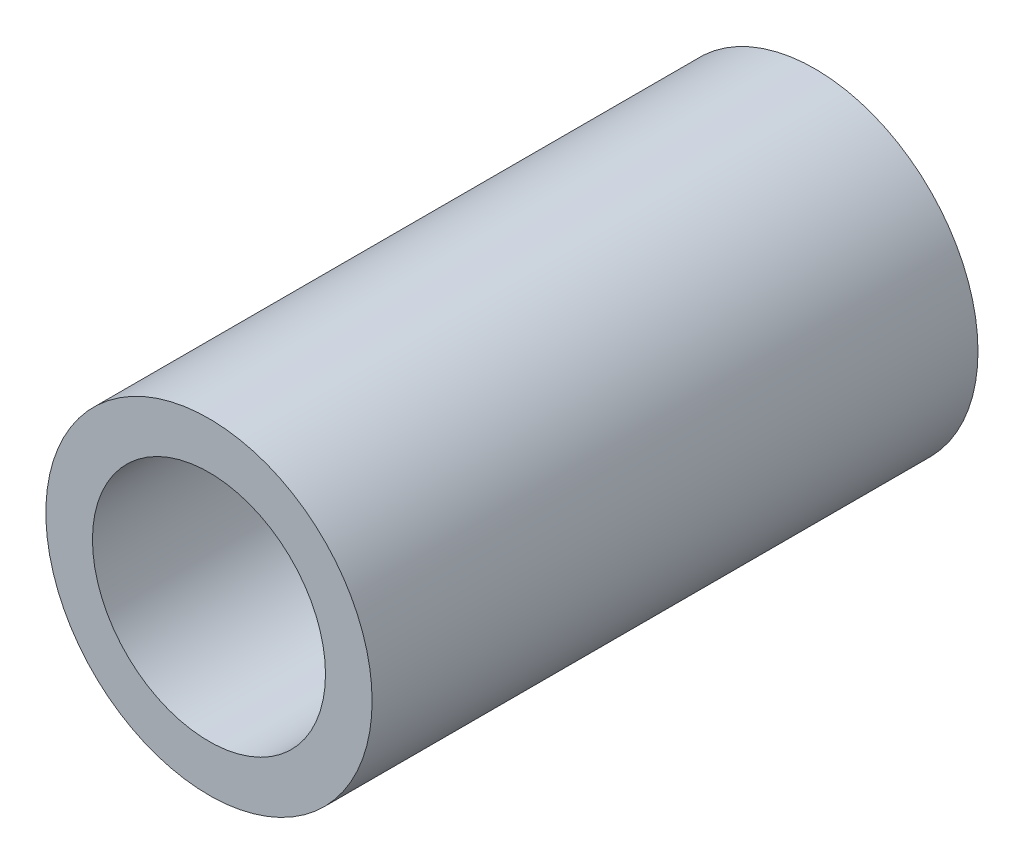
SolidWorks part; units mm, degrees
ref_plane "Face" through (0, 0, 0) normal (0, 0, 1) x (1, 0, 0)
ref_plane "Dessus" through (0, 0, 0) normal (0, 1, 0) x (1, 0, 0)
ref_plane "Droite" through (0, 0, 0) normal (1, 0, 0) x (0, 0, -1)
sketch "Esquisse1" plane through (0, 0, 0) normal (0, 0, 1) x (1, 0, 0)
  circle A0 centre (0, 0) radius 7
  dimension "D1" = 14
extrude "Extru.-Mince1" add sketch "Esquisse1" along normal blind 26 thin
sketch "Esquisse2" plane through (0, 0, 0) normal (1, 0, 0) x (0, 0, -1)
  line L1 (-27.2338, 8.8472) -> (0.9028, 8.8472)
  line L2 (-27.2338, 8.8472) -> (-27.2338, -9.1782)
  line L3 (-27.2338, -9.1782) -> (0.9028, -9.1782)
  line L4 (0.9028, 8.8472) -> (0.9028, -9.1782)
extrude "Coupe face" [suppressed] cut sketch "Esquisse2" along normal through all
